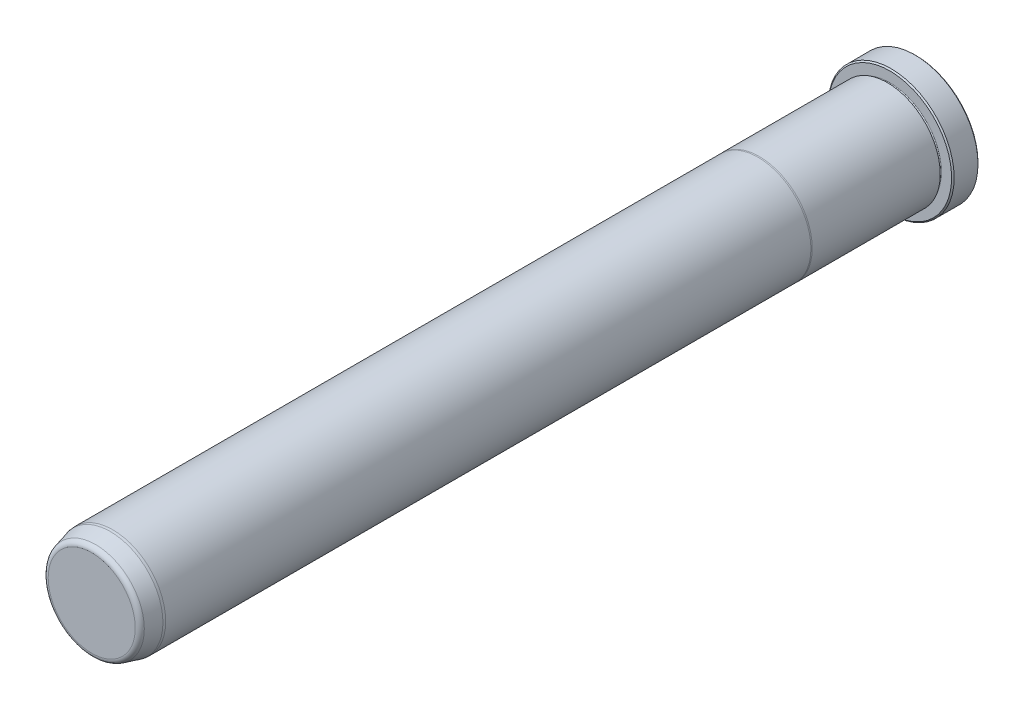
SolidWorks part; units mm, degrees
ref_plane "Front Plane" through (0, 0, 0) normal (0, 0, 1) x (1, 0, 0)
ref_plane "Top Plane" through (0, 0, 0) normal (0, 1, 0) x (1, 0, 0)
ref_plane "Right Plane" through (0, 0, 0) normal (1, 0, 0) x (0, 0, -1)
sketch "Sketch1" plane through (0, 0, 0) normal (1, 0, 0) x (0, 0, -1)
  line L0 (0, 0) -> (0, 18.923)
  line L1 (0, 18.923) -> (-7.9248, 18.923)
  line L2 (-7.9248, 18.923) -> (-7.9248, 15.4813)
  line L3 (-4.7498, 15.1003) -> (-5.5118, 15.1003) construction
  line L4 (-8.6868, 15.4813) -> (-8.6868, 15.8877)
  line L5 (-8.6868, 15.8877) -> (-47.1348, 15.8877)
  line L6 (-47.1348, 15.8877) -> (-47.498, 15.8623)
  line L7 (-47.498, 15.8623) -> (-241.3, 15.8623)
  line L9 (-247.65, 14.2983) -> (-247.65, 0)
  line L10 (-247.65, 0) -> (0, 0)
  line L11 (0, 0) -> (13.6287, 0) construction
  line L12 (-241.3, 15.8623) -> (-242.062, 15.7956)
  line L13 (-242.062, 15.7956) -> (-247.65, 14.2983)
  arc A0 (-8.6868, 15.4813) -> (-7.9248, 15.4813) centre (-8.3058, 15.4813) ccw
  dimension "D14" = 0.762
  dimension "D1" = 7.9248
  dimension "D2" = 0.762
  dimension "D3" = 37.846
  dimension "D4" = 31.7754
  dimension "D5" = 47.498
  dimension "D6" = 247.65
  dimension "D7" = 0.7874
  dimension "D8" = 4
  dimension "D9" = 31.7246
  dimension "D10" = 5
  dimension "D11" = 15
  dimension "D12" = 0.762
  dimension "D13" = 6.35
revolve "Revolve1" add sketch "Sketch1" angle 360 about L11
fillet "Fillet6" radius 1.5875 1 edges at (14.2983, 0, 247.65)
chamfer "Chamfer1" distance 0.381 angle 45 2 edges at (18.923, 0, 0) (18.923, 0, 7.9248)
